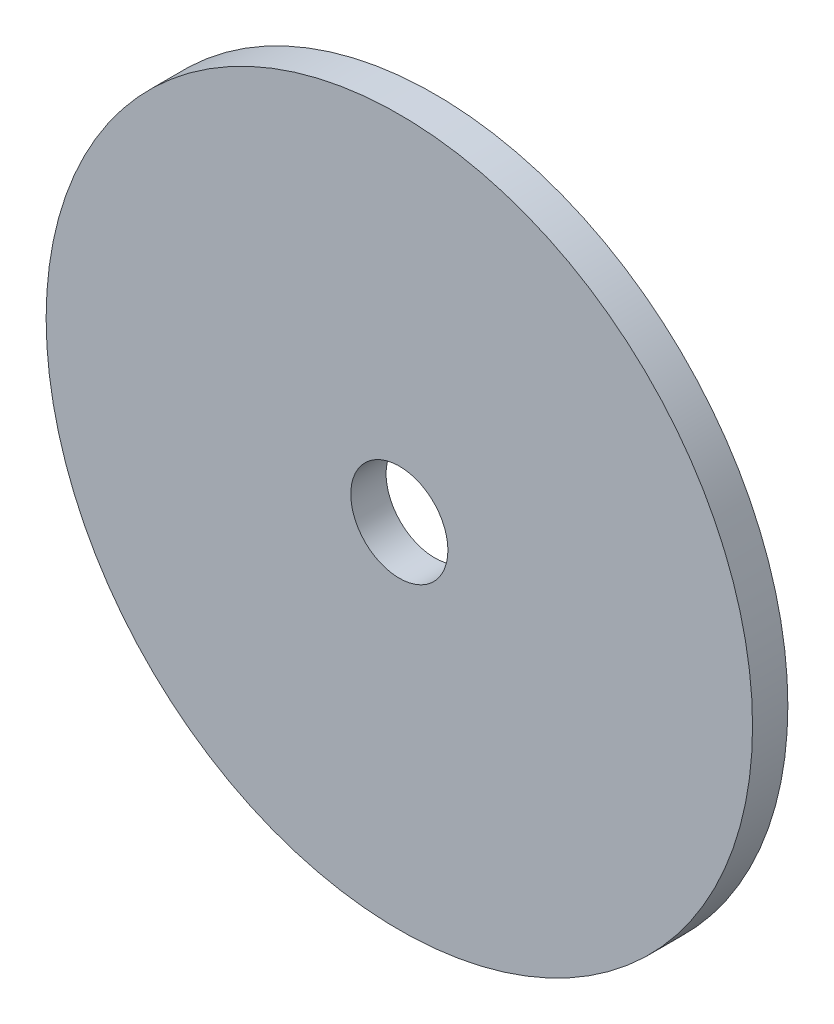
SolidWorks part; units mm, degrees
ref_plane "Front" through (0, 0, 0) normal (0, 0, 1) x (1, 0, 0)
ref_plane "Top" through (0, 0, 0) normal (0, 1, 0) x (1, 0, 0)
ref_plane "Right" through (0, 0, 0) normal (1, 0, 0) x (0, 0, -1)
sketch "Sketch1" plane through (0, 0, 0) normal (0, 0, 1) x (1, 0, 0)
  circle A0 centre (0, 0) radius 25.4
  circle A1 centre (0, 0) radius 3.4925
  dimension "D1" = 50.8
  dimension "D2" = 6.985
extrude "Boss-Extrude1" add sketch "Sketch1" along normal blind 2.54
